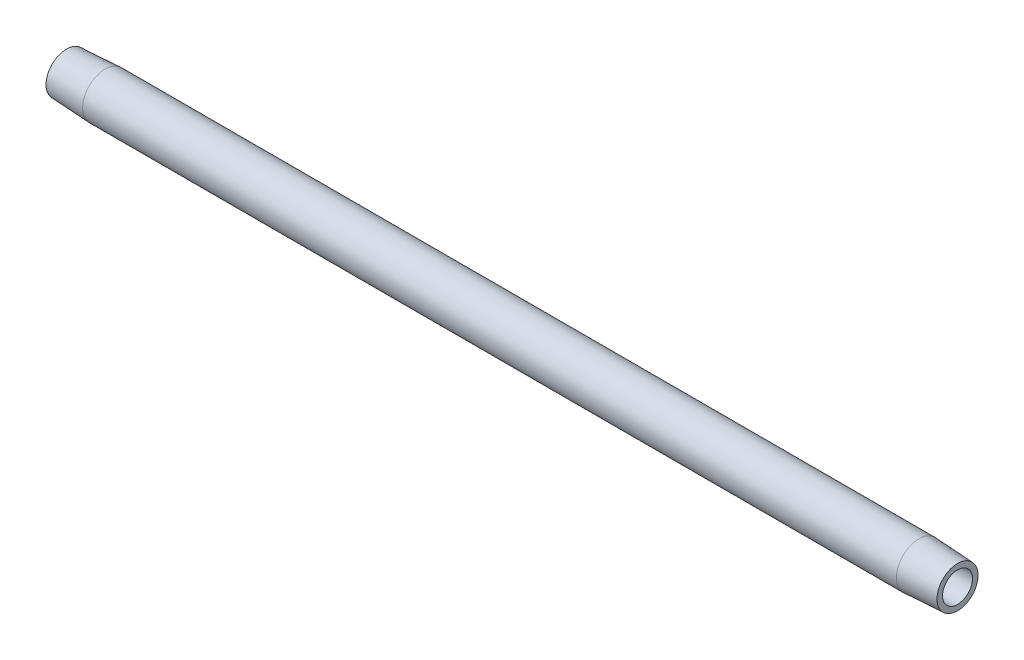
SolidWorks part; units mm, degrees
ref_plane "Front Plane" through (0, 0, 0) normal (0, 0, 1) x (1, 0, 0)
ref_plane "Top Plane" through (0, 0, 0) normal (0, 1, 0) x (1, 0, 0)
ref_plane "Right Plane" through (0, 0, 0) normal (1, 0, 0) x (0, 0, -1)
sketch "Sketch2" plane through (0, 0, 0) normal (0, 0, 1) x (1, 0, 0)
  line L0 (0.4761, 0) -> (50000.4761, 0) construction
  line L1 (0, -11.3625) -> (0, 49988.6375) construction
  line L7 (8.81, 5.1435) -> (0, 4.6818)
  line L8 (194.39, 5.1435) -> (8.81, 5.1435)
  line L9 (203.2, 4.6818) -> (194.39, 5.1435)
  line L10 (203.2, 3.4163) -> (203.2, 4.6818)
  line L11 (203.2, 3.4163) -> (0, 3.4163)
  line L12 (0, 4.6818) -> (0, 3.4163)
  dimension "D1" = 6.8326
  dimension "D2" = 10.287
  dimension "D3" = 3
  dimension "D4" = 3
  dimension "D5" = 8.81
  dimension "D6" = 8.81
  dimension "D7" = 203.2
revolve "Revolve1" add sketch "Sketch2" angle 360 about L0
